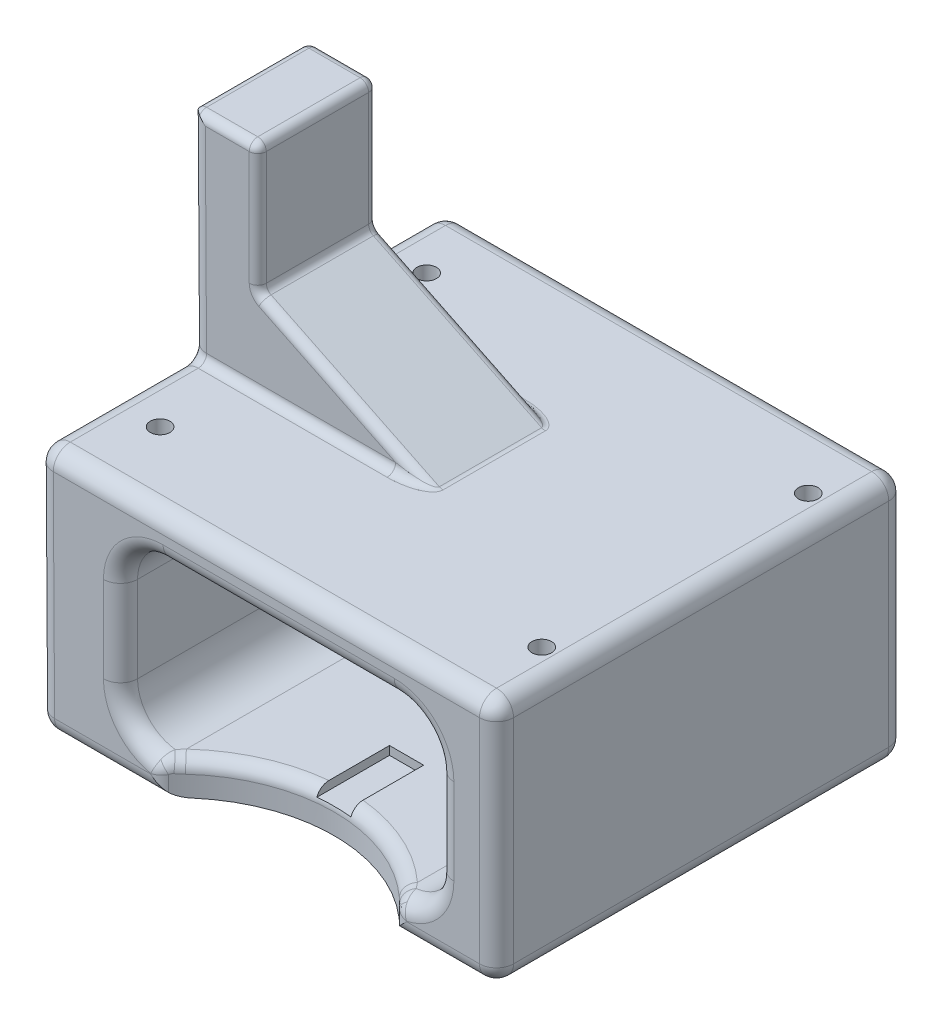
SolidWorks part; units mm, degrees
ref_plane "Front Plane" through (0, 0, 0) normal (0, 0, 1) x (1, 0, 0)
ref_plane "Top Plane" through (0, 0, 0) normal (0, 1, 0) x (1, 0, 0)
ref_plane "Right Plane" through (0, 0, 0) normal (1, 0, 0) x (0, 0, -1)
sketch "Sketch1" plane through (0, 0, 0) normal (0, 0, 1) x (1, 0, 0)
  line L1 (0, 0) -> (80, 0)
  line L2 (0, 0) -> (0, 55)
  line L3 (0, 55) -> (80, 55)
  line L4 (80, 0) -> (80, 55)
  dimension "D1" = 80
  dimension "D2" = 55
extrude "Boss-Extrude1" add sketch "Sketch1" along normal blind 50
sketch "Sketch2" plane through (0, 0, 0) normal (0, 0, -1) x (-1, 0, 0)
  line L0 (0, 0) -> (0, 25)
  line L1 (0, 55) -> (0, 0) construction
  line L2 (0, 25) -> (-15.4654, 25)
  line L3 (-80, 55) -> (-80, 50)
  line L4 (-80, 0) -> (-80, 55) construction
  line L5 (-80, 50) -> (-75, 50)
  line L7 (-70, 50) -> (-42.9, 50)
  line L8 (-75, 45) -> (-75, 34.9)
  line L9 (-70, 29.9) -> (-42.9, 29.9)
  line L10 (-37.9, 45) -> (-37.9, 34.9)
  arc A0 (-75, 34.9) -> (-70, 29.9) centre (-70, 34.9) ccw
  arc A1 (-37.9, 34.9) -> (-42.9, 29.9) centre (-42.9, 34.9) cw
  arc A2 (-42.9, 50) -> (-37.9, 45) centre (-42.9, 45) cw
  arc A3 (-70, 50) -> (-75, 45) centre (-70, 45) ccw
  point P17 (-75, 29.9)
  point P20 (-37.9, 29.9)
  dimension "D7" = 5
  dimension "D1" = 25
  dimension "D2" = 15.4654
  dimension "D3" = 5
  dimension "D4" = 5
  dimension "D5" = 20.1
  dimension "D6" = 37.1
extrude "Cut-Extrude1" cut sketch "Sketch2" against normal through all contours L7 A3 L8 A0 L9 A1 L10 A2
sketch "Sketch3" plane through (0, 0, 0) normal (0, 0, -1) x (-1, 0, 0)
  line L0 (-80, 0) -> (-80, 25.9989)
  line L1 (-80, 0) -> (-80, 55) construction
  line L3 (0, 55) -> (-28, 55)
  line L9 (-80, 25.9989) -> (-51.8667, 25.9989)
  line L14 (-28.1425, 32.6615) -> (-22.2874, 24.8235)
  line L15 (-80, 0) -> (0, 0)
  line L16 (0, 0) -> (0, 55)
  line L25 (-40.7087, 11.0623) -> (-51.8667, 25.9989)
  line L27 (-28, 55) -> (-28.1425, 32.6615)
  arc A1 (-40.7087, 11.0623) -> (-22.2874, 24.8235) centre (-31.498, 17.9429) ccw
sketch "Sketch5" plane through (0, 0, 0) normal (0, 0, -1) x (-1, 0, 0)
  line L4 (-80, 55) -> (0, 55) construction
  line L7 (-56.5, 55) -> (-28, 55)
  line L10 (0, 55) -> (-28, 55) construction
  line L11 (-28, 55) -> (-28, 80)
  line L12 (-28, 80) -> (-35.9992, 80)
  line L13 (-35.9992, 80) -> (-35.9992, 65)
  line L14 (-35.9992, 65) -> (-56.5, 55)
extrude "Boss-Extrude2" add sketch "Sketch5" against normal blind 32
sketch "Sketch8" plane through (0, 0, 0) normal (0, 0, -1) x (-1, 0, 0)
  line L0 (-28, 55) -> (-28, 80) construction
  line L1 (-28, 80) -> (-35.9992, 80) construction
  line L2 (-35.9992, 65) -> (-56.5, 55) construction
  line L3 (-35.9992, 80) -> (-35.9992, 65) construction
  line L4 (-28, 55) -> (-28, 80)
  line L5 (-28, 80) -> (-35.9992, 80)
  line L6 (-35.9992, 65) -> (-56.5, 55)
  line L7 (-35.9992, 80) -> (-35.9992, 65)
  line L8 (-56.5, 55) -> (-28, 55)
extrude "Cut-Extrude2" cut sketch "Sketch8" against normal blind 18
fillet "Fillet1" radius 1 12 edges at (42.25, 55, 18) (42.25, 55, 32) (46.2496, 60, 18) (46.2496, 60, 32) (56.5, 55, 25) (35.9992, 72.5, 18) (35.9992, 72.5, 32) (35.9992, 65, 25) (31.9996, 80, 32) (31.9996, 80, 18) (28, 80, 25) (35.9992, 80, 25)
fillet "Fillet2" radius 1 6 edges at (28, 55.2929, 32.2929) (28.2929, 79.7071, 31.7071) (28, 55.2929, 17.7071) (28.2929, 79.7071, 18.2929) (28, 67.5, 32) (28, 67.5, 18)
extrude "outer spring diameter" cut sketch "Sketch3" against normal through all
sketch "Sketch9" plane through (0, 0, 50) normal (0, 0, 1) x (1, 0, 0)
  line L0 (28.1425, 32.6615) -> (22.2874, 24.8235) construction
  line L1 (40.7087, 11.0623) -> (51.8667, 25.9989) construction
  line L2 (28.1425, 32.6615) -> (22.2874, 24.8235)
  line L3 (40.7087, 11.0623) -> (51.8667, 25.9989)
  line L13 (28.1425, 32.6615) -> (28.185, 25.9989)
  line L14 (51.8667, 25.9989) -> (28.185, 25.9989)
  arc A0 (22.2874, 24.8235) -> (40.7087, 11.0623) centre (31.498, 17.9429) ccw construction
  arc A1 (22.2874, 24.8235) -> (40.7087, 11.0623) centre (31.498, 17.9429) ccw
extrude "Cut-Extrude6" cut sketch "Sketch9" against normal blind 35
sketch "Sketch12" plane through (0, 29.9, 0) normal (0, 1, 0) x (1, 0, 0)
  line L1 (70, -50) -> (42.9, -50) construction
  line L2 (56.45, -50) -> (42.3468, -50)
  line L3 (56.45, -50) -> (70.5532, -50)
  arc A2 (70.5532, -50) -> (42.3468, -50) centre (56.45, -62.05) ccw
extrude "Cut-Extrude7" cut sketch "Sketch12" against normal mid plane 15
sketch "Sketch14" plane through (0, 0, 0) normal (0, 0, -1) x (-1, 0, 0)
  line L6 (-80, 25.9989) -> (-51.8667, 25.9989)
  line L7 (-51.8667, 25.9989) -> (-40.7087, 11.0623)
  line L8 (-22.2874, 24.8235) -> (-28.1425, 32.6615)
  line L9 (-28.1425, 32.6615) -> (-28, 55)
  line L10 (-28, 55) -> (-80, 55)
  line L11 (-80, 55) -> (-80, 25.9989)
  line L12 (-80, 25.9989) -> (-51.8667, 25.9989)
  line L13 (-51.8667, 25.9989) -> (-40.7087, 11.0623)
  line L14 (-22.2874, 24.8235) -> (-28.1425, 32.6615)
  line L15 (-28.1425, 32.6615) -> (-28, 55)
  line L16 (-28, 55) -> (-80, 55)
  line L17 (-80, 55) -> (-80, 25.9989)
  arc A1 (-40.7087, 11.0623) -> (-22.2874, 24.8235) centre (-31.498, 17.9429) ccw
  arc A2 (-40.7087, 11.0623) -> (-22.2874, 24.8235) centre (-31.498, 17.9429) ccw
  dimension "D1" = 0
extrude "Cut-Extrude8" cut sketch "Sketch14" against normal blind 2
sketch "Sketch15" plane through (0, 0, 2) normal (0, 0, -1) x (-1, 0, 0)
  circle A0 centre (-31.498, 17.9429) radius 8.5
  dimension "D1" = 17
extrude "inner spring diameter" cut sketch "Sketch15" against normal blind 7.5
sketch "Sketch16" plane through (0, 0, 9.5) normal (0, 0, -1) x (-1, 0, 0)
  circle A0 centre (-31.498, 17.9429) radius 2.25
  dimension "D1" = 4.5
extrude "Leading shaft diameter" cut sketch "Sketch16" against normal blind 19
fillet "Fillet3" radius 4 4 edges at (28.1425, 32.6615, 8.5) (28.1638, 29.3302, 15) (51.8667, 25.9989, 8.5) (40.0259, 25.9989, 15)
fillet "Fillet7" radius 1.5 3 edges at (56.45, 29.9, 43.5)
sketch "Sketch23" plane through (0, 29.9, 0) normal (0, 1, 0) x (1, 0, 0)
  line L2 (56.45, -43.9827) -> (54.45, -43.9827)
  line L3 (54.45, -43.9827) -> (54.45, -35.0012)
  line L4 (54.45, -35.0012) -> (58.45, -35.0012)
  line L5 (58.45, -35.0012) -> (58.45, -43.9827)
  line L6 (58.45, -43.9827) -> (56.45, -43.9827)
  dimension "D1" = 2
  dimension "D2" = 2
extrude "Cut-Extrude14" cut sketch "Sketch23" against normal blind 1
sketch "Sketch26" plane through (80, 0, 0) normal (1, 0, 0) x (0, 0, -1)
  line L4 (-2, 25.9989) -> (-2, 55)
  line L5 (-2, 55) -> (-50, 55)
  line L6 (-50, 55) -> (-50, 25.9989)
  line L7 (-50, 25.9989) -> (-2, 25.9989)
  line L8 (-2, 25.9989) -> (-2, 55)
  line L9 (-2, 55) -> (-50, 55)
  line L10 (-50, 55) -> (-50, 25.9989)
  line L11 (-50, 25.9989) -> (-2, 25.9989)
  dimension "D1" = 0
extrude "Boss-Extrude3" add sketch "Sketch26" along normal blind 2
fillet "Fillet8" radius 2 18 edges at (55, 55, 2) (28.067, 44.5024, 2) (27.934, 32.73, 2) (24.813, 28.2044, 2) (24.6175, 8.7322, 2) (45.6878, 17.7276, 2) (52.0792, 25.5749, 2) (67.9357, 25.9989, 2) (56.45, 50, 2) (73.5355, 48.5355, 2) (75, 39.95, 2) (73.5355, 31.3645, 2) (56.45, 29.9, 2) (39.3645, 31.3645, 2) (37.9, 39.95, 2) (39.3645, 48.5355, 2) (22.998, 17.9429, 2) (82, 40.4995, 2)
fillet "Fillet9" radius 2 26 edges at (27.0209, 24.8273, 16.1716) (35.2659, 25.9989, 50) (28.0925, 40.4995, 50) (55, 55, 50) (76.2766, 25.9989, 50) (70.5532, 27.3117, 50) (70.7962, 29.3912, 50) (74.1545, 32.1178, 50) (75, 39.95, 50) (73.5355, 48.5355, 50) (56.45, 50, 50) (39.3645, 48.5355, 50) (37.9, 39.95, 50) (38.7455, 32.1178, 50) (42.026, 29.503, 50) (42.3468, 27.3117, 50) (28.185, 25.9989, 34.5) (82, 40.4995, 50) (81.4142, 54.4142, 2.5858) (81.4142, 26.5847, 2.5858) (82, 55, 27) (82, 25.9989, 27) (28, 55, 40.634) (28, 55, 25) (28.5895, 54.4142, 2.5858) (28, 55, 11.366)
fillet "Fillet11" radius 2 7 edges at (27.934, 32.73, 17.7266) (25.9421, 29.7159, 15.4183) (23.2318, 26.0878, 15) (52.0792, 25.5749, 17.2077) (49.8208, 23.2602, 15.2041) (44.7936, 16.5306, 15) (24.6175, 8.7322, 15)
fillet "Fillet12" radius 0.5 2 edges at (33.748, 17.9429, 15) (29.248, 17.9429, 9.5)
sketch "Sketch17" plane through (0, 55, 0) normal (0, 1, 0) x (1, 0, 0)
  circle A1 centre (33.7327, -9.9278) radius 1.15
  circle A2 centre (78.4927, -9.9278) radius 1.15
  circle A3 centre (78.4927, -41.1878) radius 1.15
  circle A4 centre (33.7327, -41.1878) radius 1.15
  dimension "D2" = 2.3
  dimension "D3" = 2
  dimension "D4" = 2
extrude "Cut-Extrude11" cut sketch "Sketch17" against normal blind 17.5
sketch "Sketch18" plane through (0, 0, 2) normal (0, 0, -1) x (-1, 0, 0)
  line L1 (-5.8395, 45) -> (-90.8292, 45)
  line L2 (-90.8292, 45) -> (-90.8292, 103.2306)
  line L3 (-90.8292, 103.2306) -> (-5.8395, 103.2306)
  line L4 (-5.8395, 103.2306) -> (-5.8395, 45)
extrude "Cutting for STLs" [suppressed] cut sketch "Sketch18" against normal through all both and the other way through all
mirror "Mirror1" [suppressed] about plane through (0, 0, 0) normal (1, 0, 0)
sketch "Sketch24" [suppressed] plane through (0, 0, 2) normal (0, 0, -1) x (-1, 0, 0)
  line L0 (-3.0618, -41.6477) -> (-111.2422, -41.6477)
  line L1 (-111.2422, -41.6477) -> (-3.0618, -41.6477)
  line L2 (-3.0618, -41.6477) -> (-3.0618, 114.611)
  line L3 (-3.0618, 114.611) -> (-111.2422, 114.611)
  line L4 (-111.2422, 114.611) -> (-111.2422, -41.6477)
extrude "cutting for merror part" [suppressed] cut sketch "Sketch24" against normal blind 60 contours L3 L4 L0 L2
